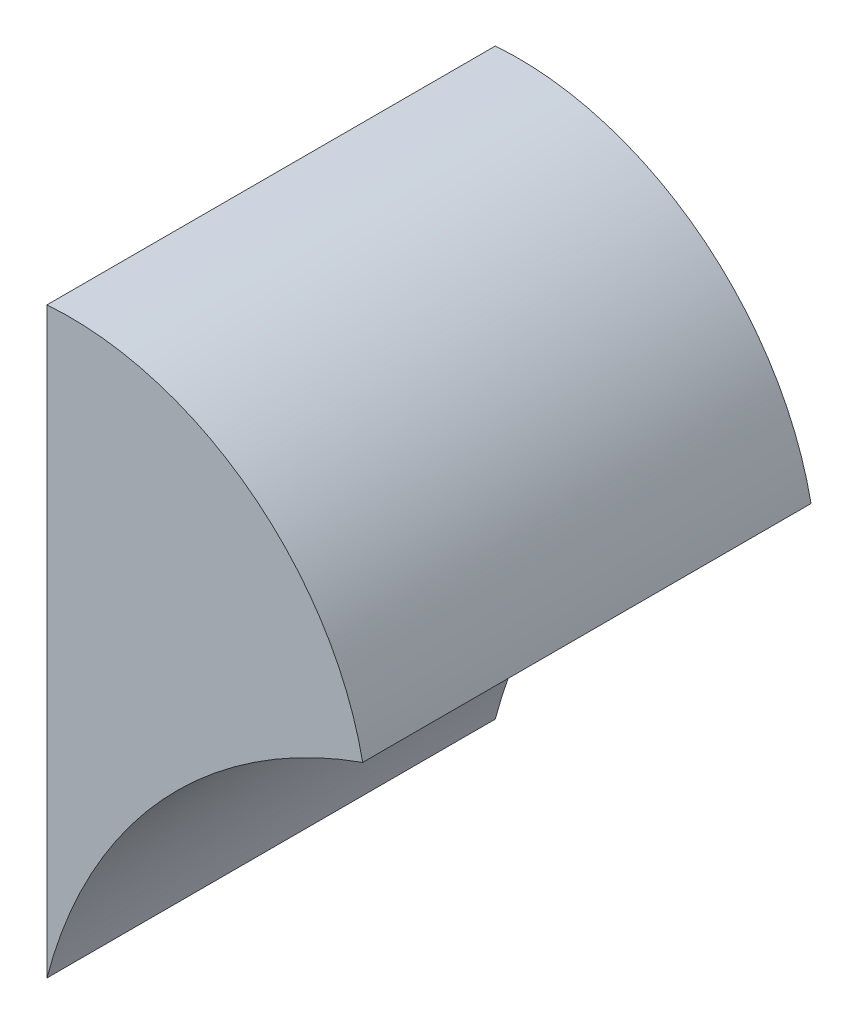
SolidWorks part; units mm, degrees
ref_plane "Plan de face" through (0, 0, 0) normal (0, 0, 1) x (1, 0, 0)
ref_plane "Plan de dessus" through (0, 0, 0) normal (0, 1, 0) x (1, 0, 0)
ref_plane "Plan de droite" through (0, 0, 0) normal (1, 0, 0) x (0, 0, -1)
sketch "Esquisse1" plane through (0, 0, 0) normal (0, 0, 1) x (1, 0, 0)
  line L0 (-26.2049, -24.4638) -> (-26.2049, -36.1654)
  arc A0 (-19.8673, -29.2489) -> (-26.2049, -24.4638) centre (-25.7466, -30.4463) ccw
  arc A1 (-26.2049, -36.1654) -> (-19.8673, -29.2489) centre (-16.5246, -38.6737) cw
  dimension "D1" = 10
  dimension "D2" = 6
  dimension "D3" = 4.7851
  dimension "D4" = 6.3376
extrude "Extrusion1" add sketch "Esquisse1" against normal blind 9 contours L0 A1 A0
